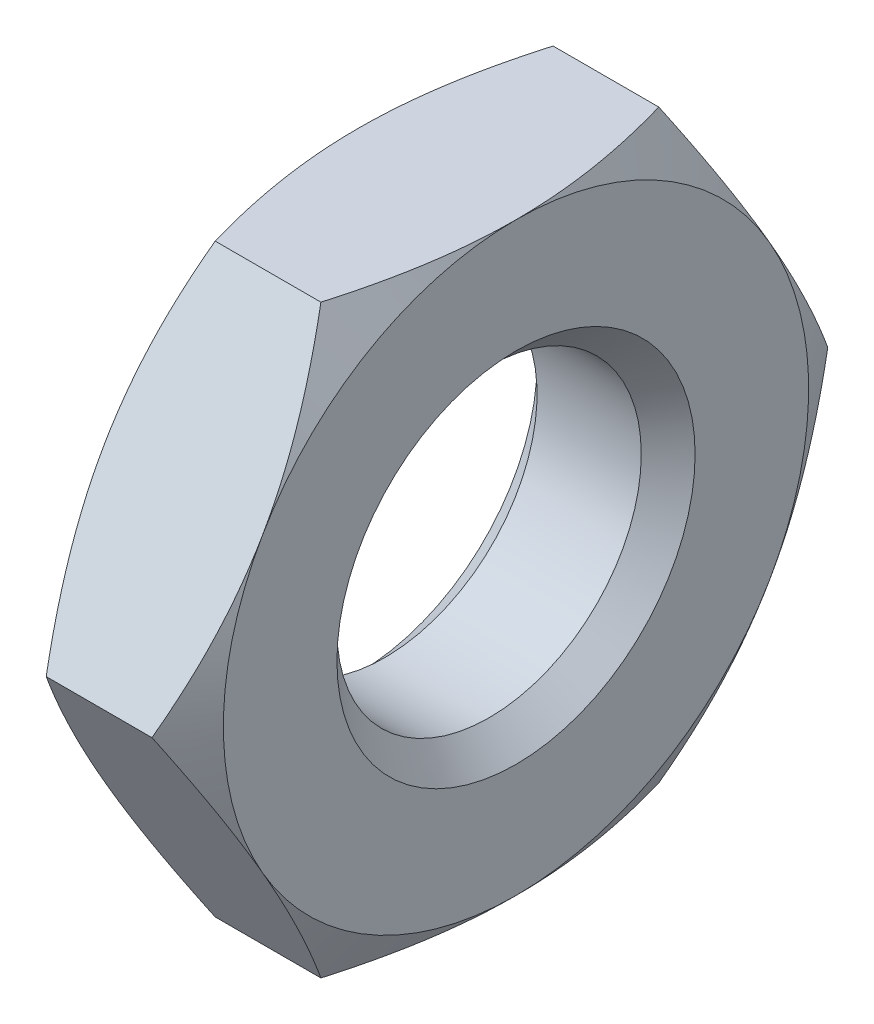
SolidWorks part; units mm, degrees
ref_plane "Front Plane" through (0, 0, 0) normal (0, 0, 1) x (1, 0, 0)
ref_plane "Top Plane" through (0, 0, 0) normal (0, 1, 0) x (1, 0, 0)
ref_plane "Right Plane" through (0, 0, 0) normal (1, 0, 0) x (0, 0, -1)
sketch "Sketch1" plane through (0, 0, 0) normal (1, 0, 0) x (0, 0, -1)
  line L1 (1.4434, 2.5) -> (-1.4434, 2.5)
  line L2 (-1.4434, 2.5) -> (-2.8868, 0)
  line L3 (-2.8868, 0) -> (-1.4434, -2.5)
  line L4 (-1.4434, -2.5) -> (1.4434, -2.5)
  line L5 (1.4434, -2.5) -> (2.8868, 0)
  line L6 (2.8868, 0) -> (1.4434, 2.5)
  circle A0 centre (0, 0) radius 2.5 construction
  circle A1 centre (0, 0) radius 1.3
extrude "Extrude1" add sketch "Sketch1" along normal blind 1.35
sketch "Sketch2" plane through (0, 0, 0) normal (0, 0, 1) x (1, 0, 0)
  line L0 (1.35, 2.5) -> (1.35, 10)
  line L1 (1.35, 10) -> (0, 10)
  line L2 (0, 10) -> (0, 2.5)
  line L3 (0, 2.5) -> (0.675, 3.6691)
  line L4 (0.675, 3.6691) -> (1.35, 2.5)
revolve "Cut-Revolve1" cut sketch "Sketch2" angle 360 about axis through (1.35, 0, 0) along (-1, 0, 0)
chamfer "Chamfer1" distance 0.23 angle 45 2 edges at (0, 0, -1.3) (1.35, 0, -1.3)
equation "\"D2@Sketch2\"=\"D1@Sketch1\"*2"
